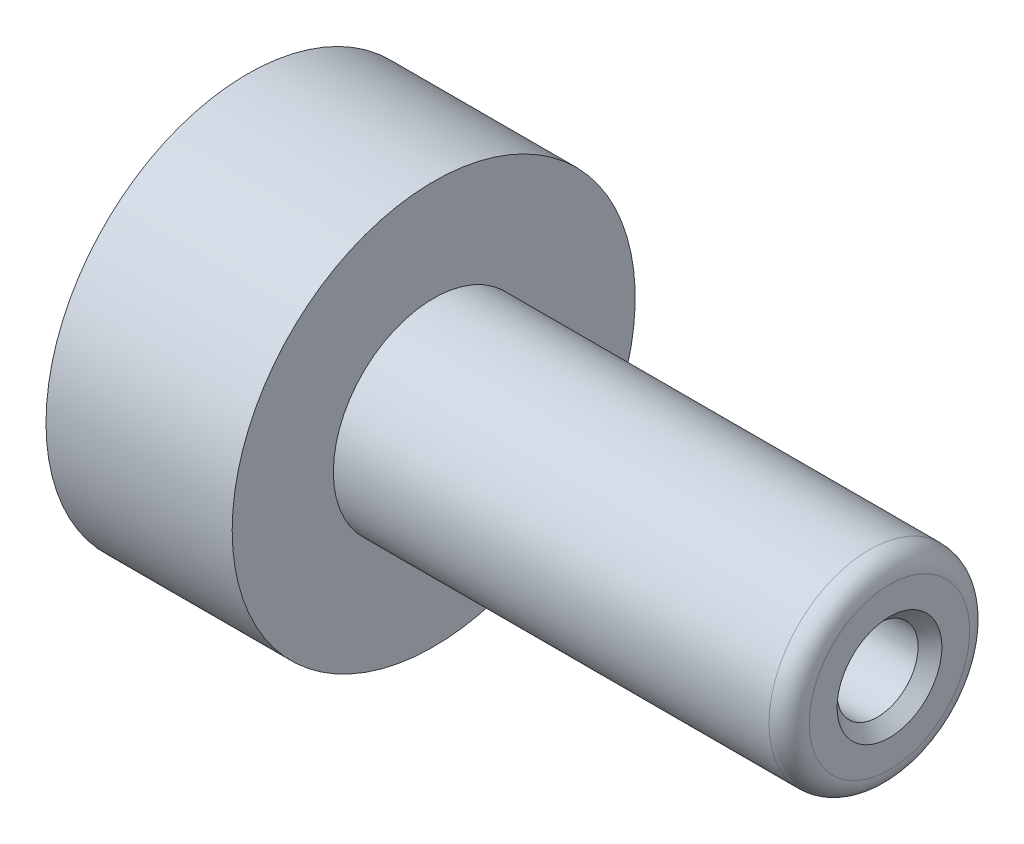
SolidWorks part; units mm, degrees
ref_plane "Front Plane" through (0, 0, 0) normal (0, 0, 1) x (1, 0, 0)
ref_plane "Top Plane" through (0, 0, 0) normal (0, 1, 0) x (1, 0, 0)
ref_plane "Right Plane" through (0, 0, 0) normal (1, 0, 0) x (0, 0, -1)
sketch "Sketch1" plane through (0, 0, 0) normal (0, 0, 1) x (1, 0, 0)
  line L0 (0, 0) -> (102.3864, 0) construction
  line L1 (0, 3.9751) -> (0, 12.7)
  line L2 (0, 12.7) -> (11.7348, 12.7)
  line L3 (11.7348, 12.7) -> (11.7348, 6.3246)
  line L4 (11.7348, 6.3246) -> (39.1922, 6.3246)
  line L5 (40.4622, 5.0546) -> (40.4622, 0)
  line L6 (40.4622, 0) -> (21.7678, 0)
  line L7 (0, 3.9751) -> (21.7678, 3.9751)
  line L8 (21.7678, 3.9751) -> (21.7678, 0)
  arc A0 (40.4622, 5.0546) -> (39.1922, 6.3246) centre (39.1922, 5.0546) ccw
  dimension "D5" = 1.27
  dimension "D1" = 11.7348
  dimension "D2" = 25.4
  dimension "D3" = 21.7678
  dimension "D4" = 7.9502
  dimension "D6" = 40.4622
  dimension "D7" = 12.6492
revolve "Revolve1" add sketch "Sketch1" angle 360 about L0
sketch "Sketch2" plane through (0, 0, 0) normal (-1, 0, 0) x (0, 0, 1)
  line L0 (0, 0) -> (9.7644, 0) construction
  circle A0 centre (0, 7.1374) radius 1.6129
  circle A1 centre (0, -7.1374) radius 1.6129
  dimension "D2" = 3.2258
  dimension "D1" = 14.2748
extrude "Cut-Extrude1" cut sketch "Sketch2" against normal blind 6.35
sketch "Sketch3" plane through (40.4622, 0, 0) normal (1, 0, 0) x (0, 0, -1)
  circle A0 centre (0, 0) radius 2.5527
  dimension "D1" = 5.1054
extrude "Cut-Extrude2" cut sketch "Sketch3" against normal blind 15.7988
chamfer "Chamfer1" distance 0.7493 angle 45 1 edges at (40.4622, 0, -2.5527)
